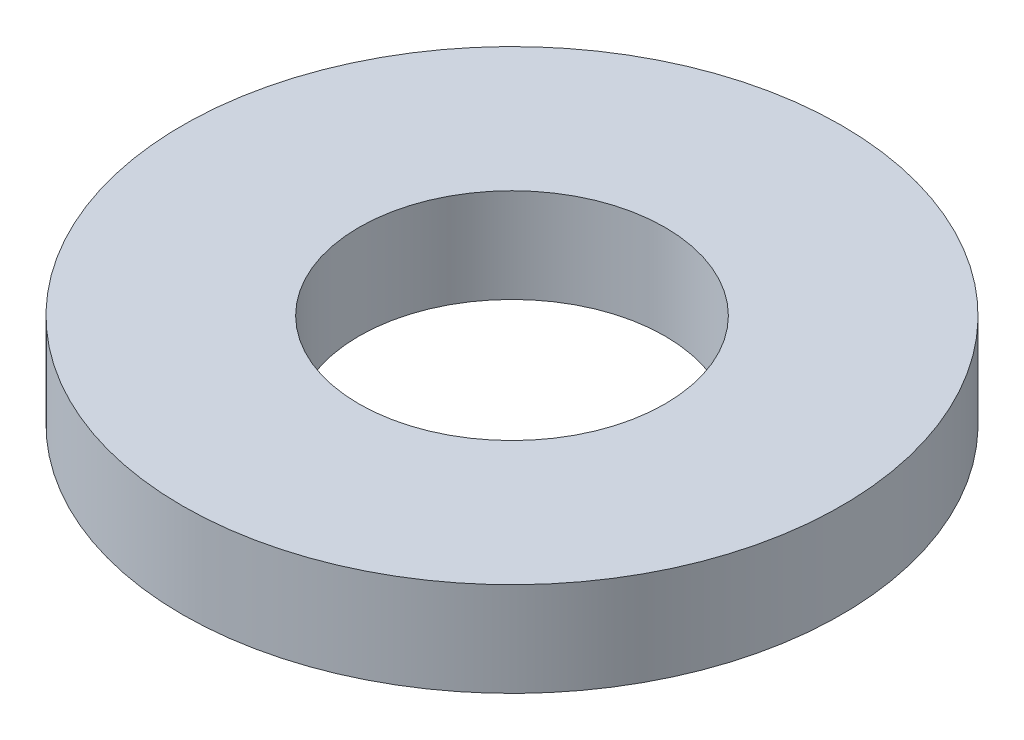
SolidWorks part; units mm, degrees
ref_plane "Front Plane" through (0, 0, 0) normal (0, 0, 1) x (1, 0, 0)
ref_plane "Top Plane" through (0, 0, 0) normal (0, 1, 0) x (1, 0, 0)
ref_plane "Right Plane" through (0, 0, 0) normal (1, 0, 0) x (0, 0, -1)
sketch "Sketch1" plane through (0, 0, 0) normal (0, 1, 0) x (1, 0, 0)
  circle A0 centre (0, 0) radius 11.1125
  circle A1 centre (0, 0) radius 5.1594
  dimension "D1" = 22.225
  dimension "D2" = 10.3187
extrude "Extrude1" add sketch "Sketch1" along normal blind 3.175
